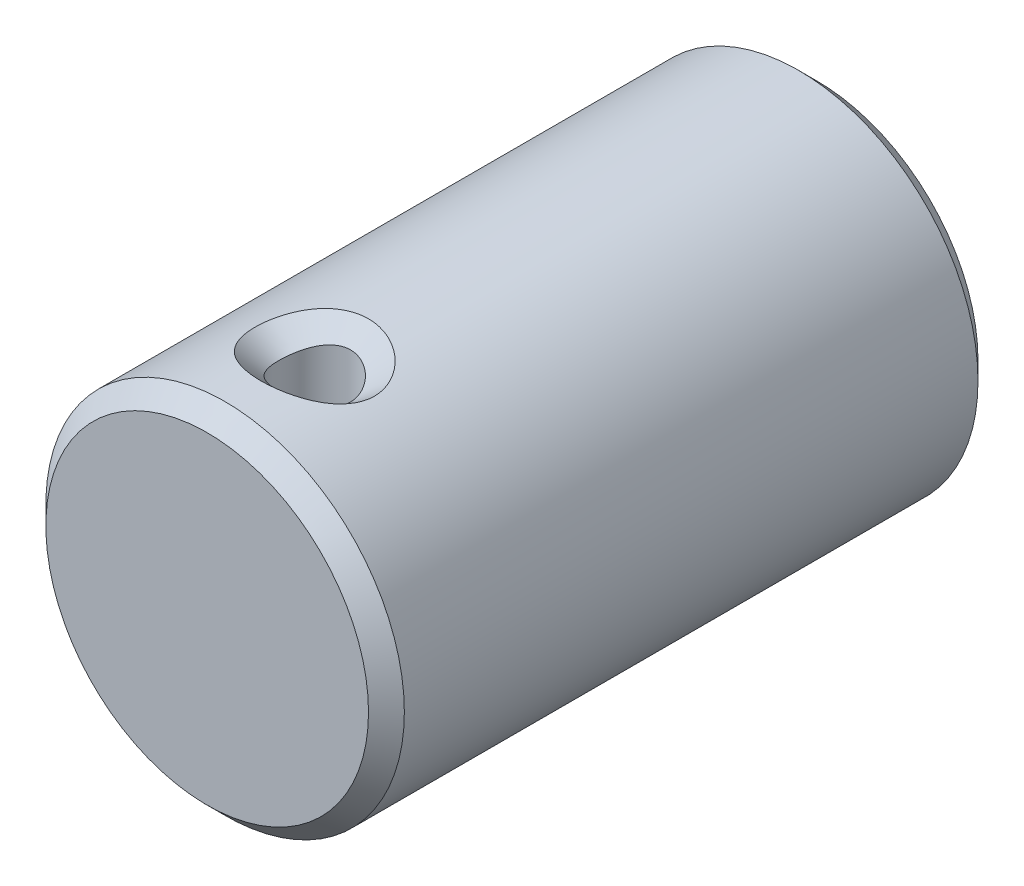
SolidWorks part; units mm, degrees
ref_plane "Plan de face" through (0, 0, 0) normal (0, 0, 1) x (1, 0, 0)
ref_plane "Plan de dessus" through (0, 0, 0) normal (0, 1, 0) x (1, 0, 0)
ref_plane "Plan de droite" through (0, 0, 0) normal (1, 0, 0) x (0, 0, -1)
sketch "Esquisse1" plane through (0, 0, 0) normal (0, 0, 1) x (1, 0, 0)
  circle A0 centre (0, 0) radius 5
  dimension "D1" = 10
extrude "Extrusion1" add sketch "Esquisse1" against normal blind 17
ref_plane "Plan1" through (0, 5, 0) normal (0, 1, 0) x (-1, 0, 0)
sketch "Esquisse2" plane through (0, 5, 0) normal (0, 1, 0) x (-1, 0, 0)
  line L2 (-5, -17) -> (5, -17) construction
  circle A0 centre (0, -3) radius 1
  dimension "D2" = 2
  dimension "D1" = 14
extrude "Enlèv. mat.-Extru.1" cut sketch "Esquisse2" against normal up to next
chamfer "Chanfrein1" distance 0.5 angle 45 4 edges at (5, 0, -17) (5, 0, 0) (-0.2078, -4.9957, -3.9782) (0.2078, 4.9957, -3.9782)
